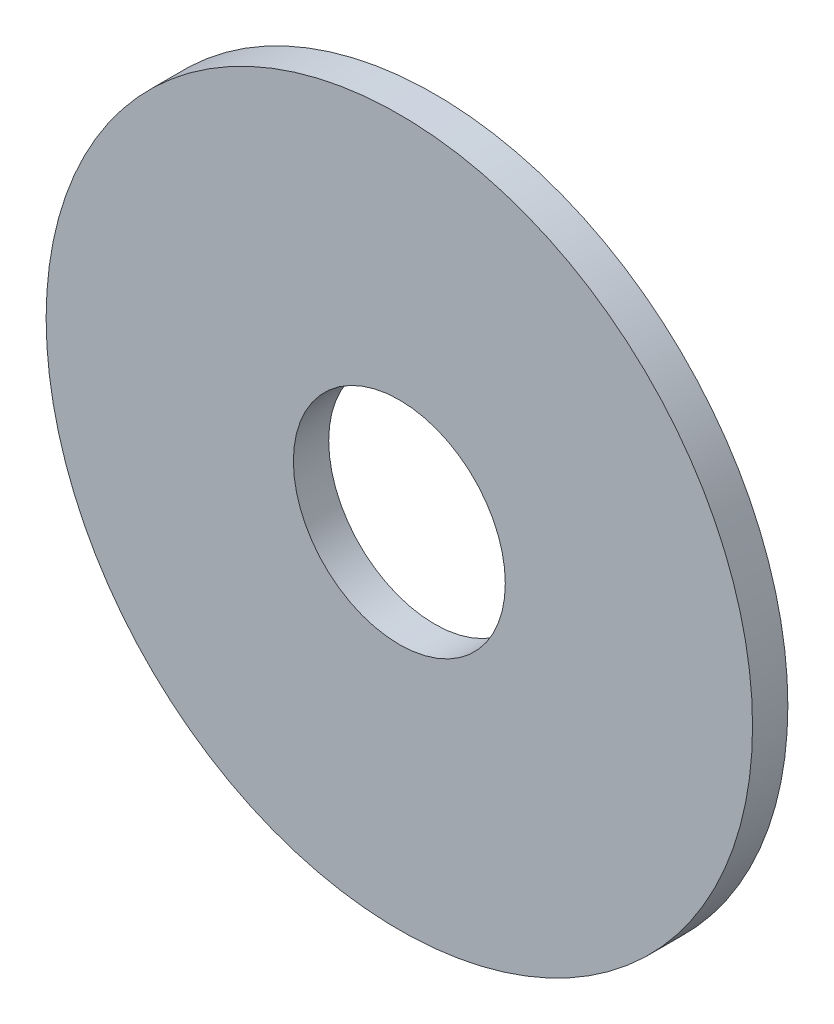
SolidWorks part; units mm, degrees
ref_plane "Face" through (0, 0, 0) normal (0, 0, 1) x (1, 0, 0)
ref_plane "Dessus" through (0, 0, 0) normal (0, 1, 0) x (1, 0, 0)
ref_plane "Droite" through (0, 0, 0) normal (1, 0, 0) x (0, 0, -1)
sketch "Esquisse1" plane through (0, 0, 0) normal (0, 0, 1) x (1, 0, 0)
  circle A0 centre (0, 0) radius 4.5
  circle A1 centre (0, 0) radius 15
  dimension "D1" = 9
  dimension "D2" = 30
extrude "Base-Extrusion" add sketch "Esquisse1" along normal blind 1.5
